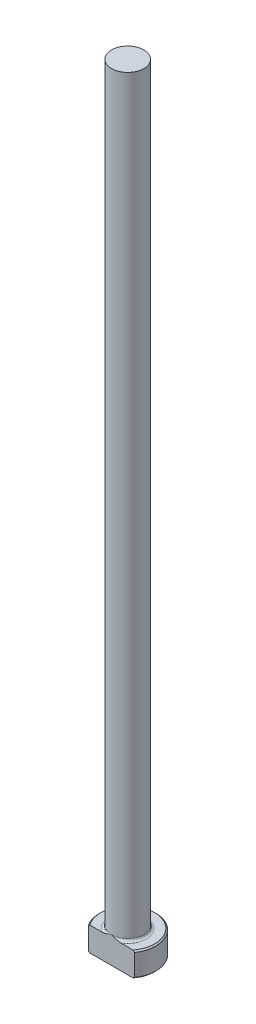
SolidWorks part; units mm, degrees
ref_plane "Front Plane" through (0, 0, 0) normal (0, 0, 1) x (1, 0, 0)
ref_plane "Top Plane" through (0, 0, 0) normal (0, 1, 0) x (1, 0, 0)
ref_plane "Right Plane" through (0, 0, 0) normal (1, 0, 0) x (0, 0, -1)
sketch "Sketch1" plane through (0, 0, 0) normal (0, 0, 1) x (1, 0, 0)
  line L0 (0, 259.9588) -> (0, -15.1925) construction
  line L1 (0, 0) -> (-5.5499, 0)
  line L2 (-5.5499, 0) -> (-5.5499, 4.7498)
  line L3 (-5.5499, 4.7498) -> (-3.175, 4.7498)
  line L4 (-3.175, 4.7498) -> (-3.175, 152.4)
  line L5 (-3.175, 152.4) -> (0, 152.4)
  line L6 (0, 152.4) -> (0, 0)
  dimension "L" = 152.4
  dimension "H" = 11.0998
  dimension "T" = 4.7498
  dimension "D" = 6.35
revolve "Revolve1" add sketch "Sketch1" angle 360 about L0
chamfer "Chamfer1" distance 0.254 angle 45 2 edges at (0, 4.7498, 5.5499) (0, 0, 5.5499)
fillet "Fillet1" radius 0.508 1 edges at (0, 4.7498, 3.175)
sketch "Sketch2" plane through (0, 0, 0) normal (0, -1, 0) x (1, 0, 0)
  line L0 (-4.552, 3.175) -> (4.552, 3.175)
  arc A0 (4.552, 3.175) -> (-4.552, 3.175) centre (0, 0) ccw
  circle A1 centre (0, 0) radius 5.5499 construction
  circle A3 centre (0, 0) radius 3.175 construction
extrude "KEY" cut sketch "Sketch2" against normal through all
sketch "Pocket Sketch" plane through (0, 0, 0) normal (0, 0, 1) x (1, 0, 0)
  line L0 (-5.9468, 0) -> (-5.9468, 4.7752)
  line L1 (-5.9468, 4.7752) -> (-4.3339, 4.7752)
  line L2 (-3.5719, 5.5372) -> (-3.5719, 22.225)
  line L3 (-3.5719, 22.225) -> (0, 22.225)
  line L4 (0, 22.225) -> (0, 0)
  line L5 (0, 0) -> (-5.9468, 0)
  line L6 (0, 12.6104) -> (0, -2.4989) construction
  line L7 (-5.5499, 4.4958) -> (-5.5499, 0.254) construction
  line L8 (5.2959, 4.7498) -> (-5.2959, 4.7498) construction
  line L9 (-3.175, 152.4) -> (-3.175, 5.2578) construction
  line L10 (-4.3339, 4.7752) -> (-3.5719, 5.5372)
  point P3 (-3.5719, 4.7752)
  dimension "D1" = 11.8935
  dimension "D2" = 0.3969
  dimension "D3" = 0.0254
  dimension "D4" = 0.3969
  dimension "D5" = 7.1437
  dimension "D6" = 22.225
